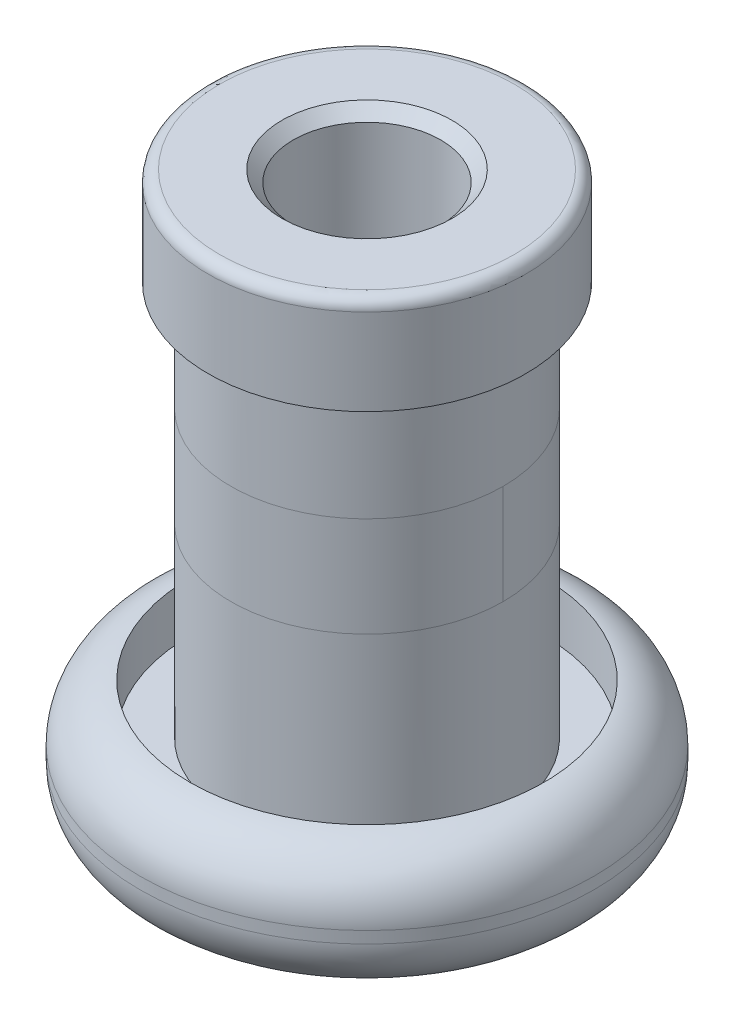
SolidWorks part; units mm, degrees
ref_plane "Front Plane" through (0, 0, 0) normal (0, 0, 1) x (1, 0, 0)
ref_plane "Top Plane" through (0, 0, 0) normal (0, 1, 0) x (1, 0, 0)
ref_plane "Right Plane" through (0, 0, 0) normal (1, 0, 0) x (0, 0, -1)
sketch "Sketch1" plane through (0, 0, 0) normal (0, 0, 1) x (1, 0, 0)
  line L0 (0, 0) -> (0, 34.8558) construction
  line L1 (5.3975, 0) -> (9.525, 0)
  line L2 (12.7, 3.175) -> (12.7, 3.8329)
  line L3 (4.1275, 31.75) -> (8.255, 31.75)
  line L4 (8.89, 31.115) -> (8.89, 26.289)
  line L5 (8.89, 26.289) -> (7.62, 26.289)
  line L6 (7.62, 26.289) -> (7.62, 4.191)
  line L7 (7.62, 4.191) -> (9.906, 4.191)
  line L8 (9.906, 4.191) -> (9.906, 6.985)
  line L9 (5.3975, 0) -> (5.3975, 3.175)
  line L10 (4.1275, 3.175) -> (4.1275, 31.75)
  line L11 (5.3975, 3.175) -> (4.1275, 3.175)
  line L12 (7.62, 26.289) -> (-7.62, 26.289) construction
  arc A0 (12.7, 3.8329) -> (9.906, 6.985) centre (9.525, 3.8329) ccw
  arc A1 (9.525, 0) -> (12.7, 3.175) centre (9.525, 3.175) ccw
  arc A2 (8.255, 31.75) -> (8.89, 31.115) centre (8.255, 31.115) cw
  point P17 (8.89, 31.75)
  dimension "D8" = 3.175
  dimension "D10" = 8.255
  dimension "D11" = 0.635
  dimension "D1" = 15.24
  dimension "D2" = 25.4
  dimension "D3" = 17.78
  dimension "D4" = 31.75
  dimension "D6" = 6.985
  dimension "D7" = 2.286
  dimension "D9" = 4.191
  dimension "D12" = 10.795
  dimension "D13" = 3.175
revolve "Revolve1" add sketch "Sketch1" angle 360 about L0
chamfer "Chamfer1" distance 0.635 angle 45 1 edges at (0, 31.75, -4.1275)
sketch "Sketch2" plane through (0, 0, 0) normal (0, 0, 1) x (1, 0, 0)
  line L0 (-7.62, 26.289) -> (-7.62, 4.191) construction
  line L1 (-7.62, 20.193) -> (7.62, 20.193)
  line L2 (-7.62, 20.193) -> (-7.62, 14.605)
  line L3 (-7.62, 14.605) -> (7.62, 14.605)
  line L4 (7.62, 20.193) -> (7.62, 14.605)
  line L5 (-4.6383, 20.193) -> (-8.8872, 20.193) construction
  line L6 (7.62, 4.191) -> (7.62, 26.289) construction
  line L7 (4.6383, 14.605) -> (8.8872, 14.605) construction
